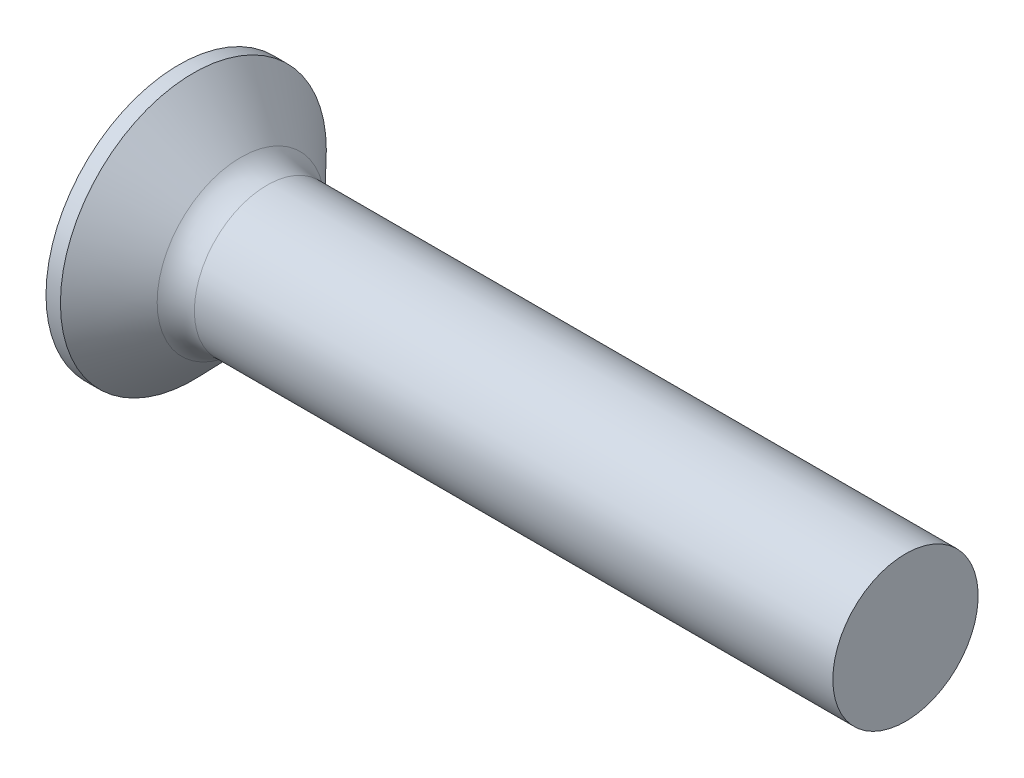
SolidWorks part; units mm, degrees
ref_plane "Plane1" through (0, 0, 0) normal (0, 0, 1) x (1, 0, 0)
ref_plane "Plane2" through (0, 0, 0) normal (0, 1, 0) x (1, 0, 0)
ref_plane "Plane3" through (0, 0, 0) normal (1, 0, 0) x (0, 0, -1)
sketch "BodySke" plane through (0, 0, 0) normal (0, 0, 1) x (1, 0, 0)
  line L0 (0, 0) -> (52.3, 0)
  line L1 (52.3, 0) -> (52.3, 5)
  line L2 (52.3, 5) -> (7.3, 5)
  line L3 (3.2924, -9.15) -> (7.3, -5) construction
  line L4 (-15.875, 0) -> (82.55, 0) construction
  line L5 (3.2924, 9.15) -> (7.3, 5)
  line L6 (8.8, 8.175) -> (8.8, -7.7) construction
  line L7 (2.3, 2.7793) -> (2.3, -13.0957) construction
  line L8 (3.2924, 9.15) -> (2.3, 9.15)
  arc A0 (0, 0) -> (2.3, 9.15) centre (19.3505, 0) cw
  dimension "Length" = 50
  dimension "Diameter" = 10
  dimension "Head_dia" = 18.3
  dimension "Head_ang" = 92
  dimension "Advance" = 1.5
  dimension "Thread_nom" = 50
  dimension "Oval_ht" = 2.3
  dimension "Side_ht" = 5
revolve "Base-Revolve" add sketch "BodySke" angle 360 about L4
fillet "Fillet1" radius 2.5 1 edges at (7.3, 0, 5)
sketch "Sketch3" plane through (0, 0, 0) normal (1, 0, 0) x (0, 0, -1)
  line L0 (1.08, -5.15) -> (-1.08, -5.15)
  line L1 (1.08, -5.15) -> (1.08, 5.15)
  line L2 (-1.08, 5.15) -> (1.08, 5.15)
  line L3 (-1.08, 5.15) -> (-1.08, -5.15)
  dimension "D1" = 1.08
  dimension "Cross_width" = 2.16
  dimension "D2" = 5.15
  dimension "Cross_dia" = 10.3
ref_plane "Plane4" through (6.05, 0, 0) normal (1, 0, 0) x (0, 0, -1)
sketch "Sketch4" plane through (6.05, 0, 0) normal (1, 0, 0) x (0, 0, -1)
  line L0 (1.08, -2.1336) -> (-1.08, -2.1336)
  line L1 (1.08, -2.1336) -> (1.08, 2.1336)
  line L2 (-1.08, 2.1336) -> (1.08, 2.1336)
  line L3 (-1.08, 2.1336) -> (-1.08, -2.1336)
  dimension "D1" = 2.16
  dimension "D2" = 4.2672
  dimension "D3" = 1.08
  dimension "D4" = 2.1336
loft "Recess" cut profiles "Sketch3", "Sketch4"
pattern_circular "RecPat" count 2 every 90 about axis through (0, 0, 0) along (1, 0, 0) of "Recess"
sketch "RecCorSke" plane through (0, 0, 0) normal (0, 0, 1) x (1, 0, 0)
  line L0 (-3.175, 0) -> (15.875, 0) construction
  line L2 (0, 0) -> (0, 2.3536)
  line L3 (0, 2.3536) -> (6.05, 1.9305)
  line L4 (6.05, 1.9305) -> (6.6773, 0)
  line L5 (6.6773, 0) -> (0, 0)
  dimension "Diameter" = 3.861
  dimension "Depth" = 6.05
  dimension "Draft_angle" = 4
  dimension "Bottom_angle" = 18
revolve "RecessCore" cut sketch "RecCorSke" angle 360 about L0
sketch "ThdSchSke" plane through (0, 0, 0) normal (0, 0, 1) x (1, 0, 0)
  line L0 (8.8, -4.172) -> (8.2202, -5)
  line L1 (8.8, -4.172) -> (9.3798, -5)
  line L2 (9.3798, -5) -> (9.3798, -6.25)
  line L3 (-3.175, 0) -> (5.1513, 0) construction
  line L5 (9.3798, -6.25) -> (8.2202, -6.25)
  line L6 (8.2202, -6.25) -> (8.2202, -5)
  dimension "Thread_minor" = 8.344
  dimension "Diameter" = 10
  dimension "Start" = 8.8
  dimension "SideAngle" = 55
  dimension "VeeAngle" = 70
  dimension "Overcut" = 12.5
revolve "ThreadSchematic" [suppressed] cut sketch "ThdSchSke" angle 360 about L3
pattern_linear "ThdSchPat" [suppressed]
equation "\"D1@Sketch3\" = \"Cross_width@Sketch3\" / 2"
equation "\"D2@Sketch3\" = \"Cross_dia@Sketch3\" / 2"
equation "\"Depth@RecCorSke\" = \"Cross_depth@Plane4\""
equation "\"D1@Sketch4\" = \"Cross_width@Sketch3\""
equation "\"D2@Sketch4\" = \"Cross_dia@Sketch3\" - 2.0 * \"Cross_depth@Plane4\" * tan(26.5  * 0.017453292)"
equation "\"D3@Sketch4\" = \"D1@Sketch4\" / 2"
equation "\"D4@Sketch4\" = \"D2@Sketch4\" / 2"
equation "\"Thread_length@ThreadCosmetic\" = ((sgn( (\"Length@BodySke\" - \"Advance@BodySke\" - \"Side_ht@BodySke\" ) - \"Thread_nom@BodySke\" )-1)*( (\"Length@BodySke\" - \"Advance@BodySke\" - \"Side_ht@BodySke\" ) - \"Thread_"
equation "\"Thread_minor@ThdSchSke\" = \"Thread_minor@ThreadCosmetic\""
equation "\"Diameter@ThdSchSke\" = \"Diameter@BodySke\""
equation "\"Overcut@ThdSchSke\" = \"Diameter@BodySke\" * 1.25"
equation "\"Start@ThdSchSke\" = \"Oval_ht@BodySke\" + \"Length@BodySke\" - \"Thread_length@ThreadCosmetic\"  '---Countersunk---"
equation "\"Num_threads@ThdSchPat\" = int( \"Thread_length@ThreadCosmetic\" / \"Advance@BodySke\" + 0.999 )  + 1"
equation "\"Advance@ThdSchPat\" = \"Thread_length@ThreadCosmetic\" /  (\"Num_threads@ThdSchPat\" - 1) 'relax it"
